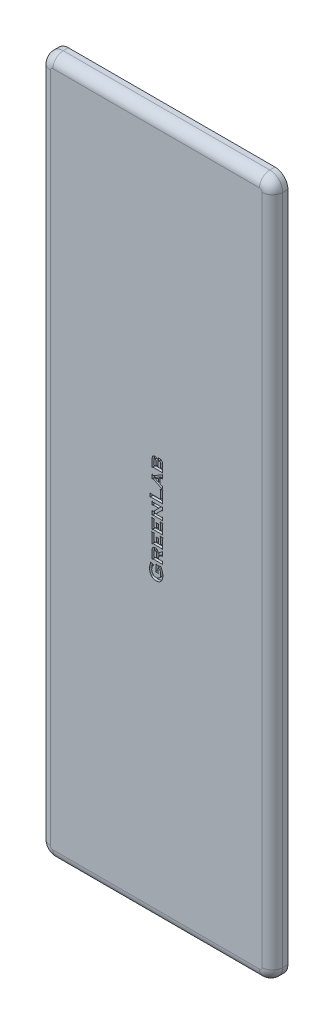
SolidWorks part; units mm, degrees
ref_plane "Front Plane" through (0, 0, 0) normal (0, 0, 1) x (1, 0, 0)
ref_plane "Top Plane" through (0, 0, 0) normal (0, 1, 0) x (1, 0, 0)
ref_plane "Right Plane" through (0, 0, 0) normal (1, 0, 0) x (0, 0, -1)
ref_plane "Plane1" through (0, 0, 3) normal (0, 0, 1) x (1, 0, 0)
sketch "Sketch1" plane through (0, 0, 3) normal (0, 0, 1) x (1, 0, 0)
  line L0 (-22.5, 67.5) -> (-22.5, -67.5)
  line L1 (-22.5, -67.5) -> (22.5, -67.5)
  line L2 (22.5, -67.5) -> (22.5, 67.5)
  line L3 (22.5, 67.5) -> (-22.5, 67.5)
  dimension "D1" = 45
  dimension "D2" = 135
extrude "Boss-Extrude1" add sketch "Sketch1" against normal blind 3
fillet "Fillet1" radius 2.5 4 edges at (-22.5, -67.5, 1.5) (-22.5, 67.5, 1.5) (22.5, -67.5, 1.5) (22.5, 67.5, 1.5)
fillet "Fillet2" radius 2 8 edges at (22.5, 0, 3) (21.7678, 66.7678, 3) (21.7678, -66.7678, 3) (0, 67.5, 3) (0, -67.5, 3) (-21.7678, 66.7678, 3) (-21.7678, -66.7678, 3) (-22.5, 0, 3)
sketch "Sketch2" plane through (0, 0, 3) normal (0, 0, 1) x (1, 0, 0)
  line L0 (1.25, 65.5) -> (1.25, -65.5) construction
  line L1 (20, 65.5) -> (-20, 65.5) construction
  line L2 (-20, -65.5) -> (20, -65.5) construction
  line L3 (22.5, 65) -> (22.5, -65) construction
  text T0 "GreenLab" font "Copperplate Gothic Bold" height 2.5
  dimension "D1" = 21.25
extrude "Cut-Extrude1" cut sketch "Sketch2" against normal blind 0.5
